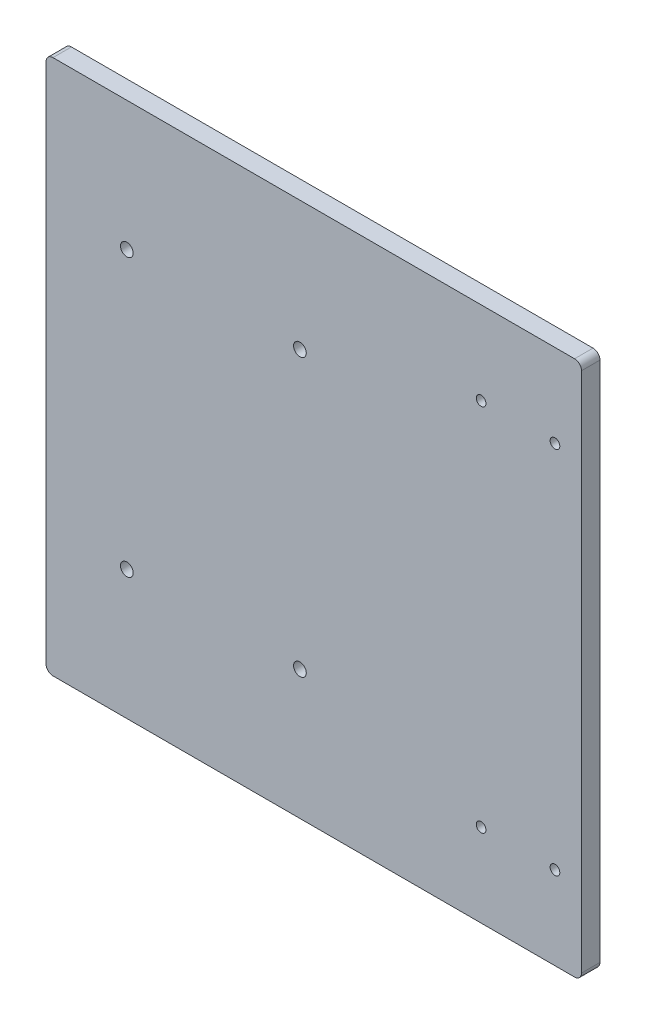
SolidWorks part; units mm, degrees
ref_plane "Przednia" through (0, 0, 0) normal (0, 0, 1) x (1, 0, 0)
ref_plane "Górna" through (0, 0, 0) normal (0, 1, 0) x (1, 0, 0)
ref_plane "Prawa" through (0, 0, 0) normal (1, 0, 0) x (0, 0, -1)
sketch "Szkic1" plane through (0, 0, 0) normal (0, 0, 1) x (1, 0, 0)
  line L1 (0, 0) -> (232, 0)
  line L2 (0, 0) -> (0, 232)
  line L3 (0, 232) -> (232, 232)
  line L4 (232, 0) -> (232, 232)
  dimension "D1" = 232
  dimension "D2" = 232
extrude "Dodanie-wyciągnięcie1" add sketch "Szkic1" along normal blind 8
chamfer "Sfazowanie1" [suppressed] distance 7.8 angle 45
hole_wizard "Pogłębienie stożkowe pod M5 wkręt do części metalowych z łbem soczewkowym1" positions "Szkic5" profile "Szkic4" countersink size "M5" standard "Ansi Metric"
sketch "Szkic5" plane through (0, 0, 0) normal (0, 0, -1) x (-1, 0, 0)
  line L0 (-35, 176) -> (-35, 56) construction
  line L3 (-35, 116) -> (0, 116) construction
  line L4 (0, 232) -> (0, 0) construction
  line L5 (-35, 176) -> (-110, 176) construction
  line L6 (-110, 176) -> (-110, 56) construction
  line L7 (-110, 56) -> (-35, 56) construction
  point P0 (-35, 56)
  point P2 (-35, 176)
  point P16 (-110, 56)
  point P18 (-110, 176)
  dimension "D1" = 110
  dimension "D2" = 120
  dimension "D3" = 35
sketch "Szkic4" plane through (35, 56, 0) normal (1, 0, 0) x (0, 1, 0)
  line L0 (0, 0) -> (0, 8)
  line L1 (0, 8) -> (2.75, 8)
  line L2 (2.75, 8) -> (2.75, 2.45)
  line L3 (2.75, 2.45) -> (5.2, 0)
  line L5 (5.2, 0) -> (0, 0)
  line L6 (-2.75, 2.45) -> (-5.2, 0) construction
  line L11 (0, -6.35) -> (0, 107.95) construction
  dimension "Średnica otworu na wylot" = 5.5
  dimension "Głębokość otworu na wylot" = 8
  dimension "Średnica zewnętrznego pogłębienia stożkowego" = 10.4
  dimension "Kąt zewnętrznego pogłębienia stożkowego" = 90
hole_wizard "Otwór gwintowany M4x0.72" positions "Szkic7" profile "Szkic6" tap size "M4x0.7" standard "Ansi Metric"
sketch "Szkic7" [suppressed] plane through (116.1, 0, -116.1) normal (0.7071, 0, -0.7071) x (-0.7071, 0, -0.7071)
  line L0 (-166.6902, 205) -> (-166.6902, 25)
  line L3 (-166.6902, 115) -> (-164.1902, 115)
  line L4 (-164.1902, 230) -> (-164.1902, 0) construction
  point P0 (-166.6902, 25)
  point P2 (-166.6902, 205)
  dimension "D1" = 180
  dimension "D2" = 2.5
sketch "Szkic6" plane through (233.9678, 25, 1.7678) normal (0, 1, 0) x (-0.7071, 0, -0.7071)
  line L0 (0, 0) -> (0, 8.8137)
  line L1 (0, 8.8137) -> (1.65, 8.8137)
  line L2 (1.65, 8.8137) -> (1.65, 0)
  line L5 (1.65, 0) -> (0, 0)
  line L11 (0, -6.35) -> (0, 107.95) construction
  dimension "Średnica otworu gwintowanego na wylot" = 3.3
  dimension "Głębokość otworu gwintowanego na wylot" = 8.8137
sketch "Szkic8" plane through (0, 0, 0) normal (0, 0, -1) x (-1, 0, 0)
  line L1 (-250, 231) -> (0, 231)
  line L2 (-250, 231) -> (-250, 225)
  line L3 (-250, 225) -> (0, 225)
  line L4 (0, 231) -> (0, 225)
  line L5 (0, 232) -> (0, 0) construction
  line L6 (0, 0) -> (-232, 0) construction
  line L7 (-232, 232) -> (0, 232) construction
  line L8 (0, 7) -> (-250, 7)
  line L9 (0, 7) -> (0, 1)
  line L10 (0, 1) -> (-250, 1)
  line L11 (-250, 225) -> (-250, 7) construction
  line L12 (-250, 7) -> (-250, 1)
  dimension "D1" = 1
  dimension "D2" = 6
  dimension "D3" = 1
  dimension "D4" = 6
  dimension "D5" = 250
extrude "Wytnij-wyciągnięcie1" [suppressed] cut sketch "Szkic8" against normal blind 1.5
hole_wizard "Otwór gwintowany M5x0.81" positions "Szkic10" profile "Szkic9" tap size "M5x0.8" standard "Ansi Metric"
sketch "Szkic10" plane through (0, 0, 8) normal (0, 0, 1) x (1, 0, 0)
  line L0 (188.5, 196) -> (220.5, 196)
  line L1 (220.5, 196) -> (220.5, 36)
  line L2 (220.5, 36) -> (188.5, 36)
  line L3 (188.5, 36) -> (188.5, 196)
  line L7 (220.5, 116) -> (232, 116)
  line L8 (232, 0) -> (232, 232) construction
  point P0 (220.5, 196)
  point P2 (220.5, 36)
  point P4 (188.5, 36)
  point P6 (188.5, 196)
  dimension "D1" = 32
  dimension "D2" = 11.5
  dimension "D3" = 160
sketch "Szkic9" plane through (220.5, 196, 8) normal (1, 0, 0) x (0, -1, 0)
  line L0 (0, 0) -> (0, 8)
  line L1 (0, 8) -> (2.1, 8)
  line L2 (2.1, 8) -> (2.1, 0)
  line L5 (2.1, 0) -> (0, 0)
  line L11 (0, -6.35) -> (0, 107.95) construction
  dimension "Średnica otworu gwintowanego na wylot" = 4.2
  dimension "Głębokość otworu gwintowanego na wylot" = 8
fillet "Zaokrąglenie1" radius 3 4 edges at (232, 232, 4) (232, 0, 4) (0, 0, 4) (0, 232, 4)
